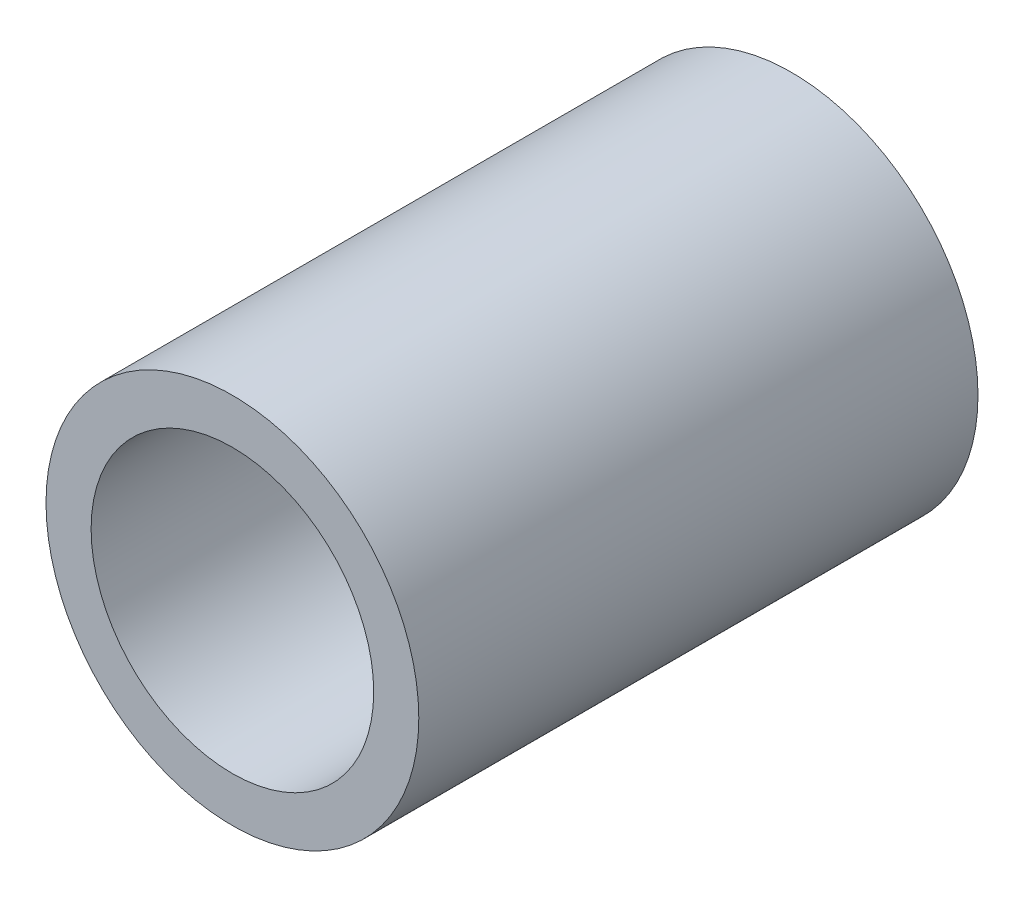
SolidWorks part; units mm, degrees
ref_plane "Front Plane" through (0, 0, 0) normal (0, 0, 1) x (1, 0, 0)
ref_plane "Top Plane" through (0, 0, 0) normal (0, 1, 0) x (1, 0, 0)
ref_plane "Right Plane" through (0, 0, 0) normal (1, 0, 0) x (0, 0, -1)
sketch "Sketch1" plane through (0, 0, 0) normal (0, 0, 1) x (1, 0, 0)
  circle A0 centre (0, 0) radius 6.35
  circle A1 centre (0, 0) radius 4.8133
  dimension "D1" = 12.7
  dimension "ID" = 9.6266
extrude "Extrude1" add sketch "Sketch1" along normal mid plane 19.05
sketch "Sketch2" plane through (0, 0, 0) normal (1, 0, 0) x (0, 0, -1)
  line L0 (-9.525, -4.8133) -> (9.525, -4.8133) construction
  line L3 (9.525, 4.8133) -> (-9.525, 4.8133) construction
  line L5 (-9.525, -4.8133) -> (9.525, -4.8133)
  line L6 (9.525, 4.8133) -> (-9.525, 4.8133)
sketch "Sketch4" plane through (0, 0, 9.525) normal (0, 0, 1) x (1, 0, 0)
  line L0 (0, 0) -> (-3.4035, 3.4035)
  line L1 (0, -24.4475) -> (0, 24.4475) construction
  circle A0 centre (0, 0) radius 4.8133 construction
  dimension "D1" = 45
